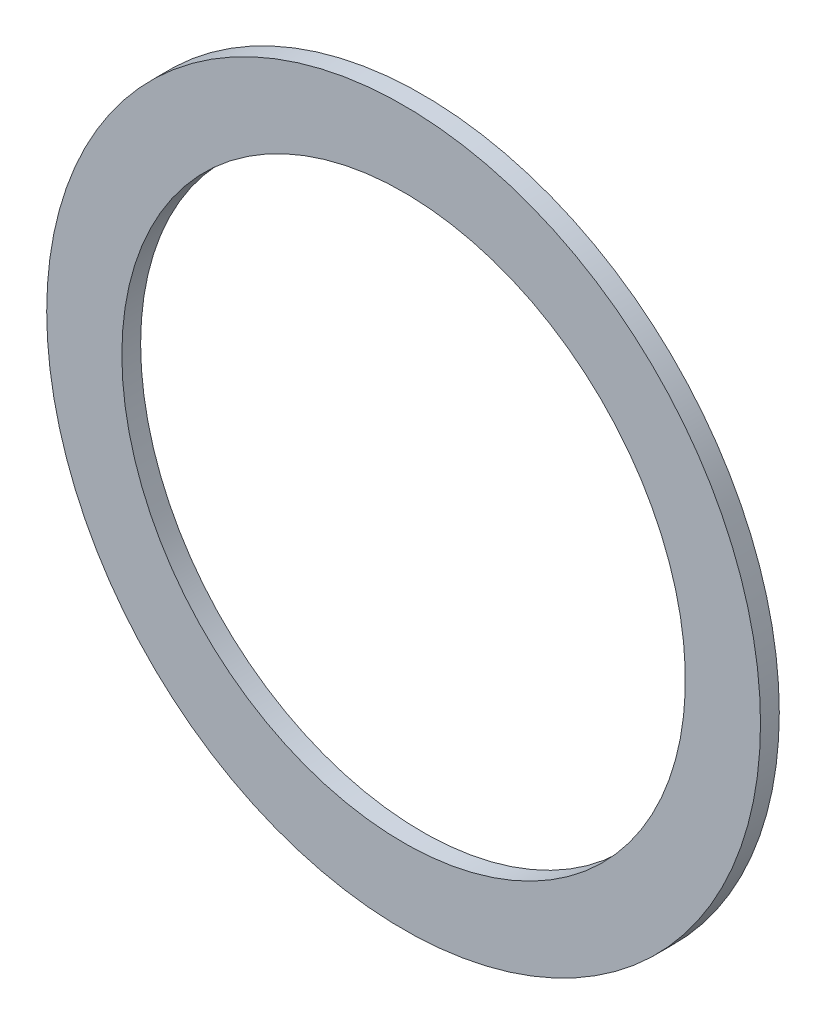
SolidWorks part; units mm, degrees
ref_plane "Face" through (0, 0, 0) normal (0, 0, 1) x (1, 0, 0)
ref_plane "Dessus" through (0, 0, 0) normal (0, 1, 0) x (1, 0, 0)
ref_plane "Profil" through (0, 0, 0) normal (1, 0, 0) x (0, 0, -1)
sketch "Esquisse1" plane through (0, 0, 0) normal (0, 0, 1) x (1, 0, 0)
  circle A0 centre (0, 0) radius 19
  dimension "D1" = 38
extrude "Base-Extrusion" add sketch "Esquisse1" along normal blind 1
sketch "Esquisse2" plane through (0, 0, 0) normal (0, 0, -1) x (-1, 0, 0)
  circle A0 centre (0, 0) radius 15
  dimension "D1" = 30
extrude "Enlèv. mat.-Extru.1" cut sketch "Esquisse2" against normal through all
sketch "Esquisse3" plane through (0, 0, 0) normal (0, 0, -1) x (-1, 0, 0)
  line L0 (0, 0) -> (0, 21.9492)
  line L1 (0, 0) -> (-15.5205, -15.5205)
  arc A0 (-15.5205, -15.5205) -> (0, 21.9492) centre (0, 0) cw
  dimension "D1" = 135
extrude "Coupe" cut sketch "Esquisse3" against normal through all
